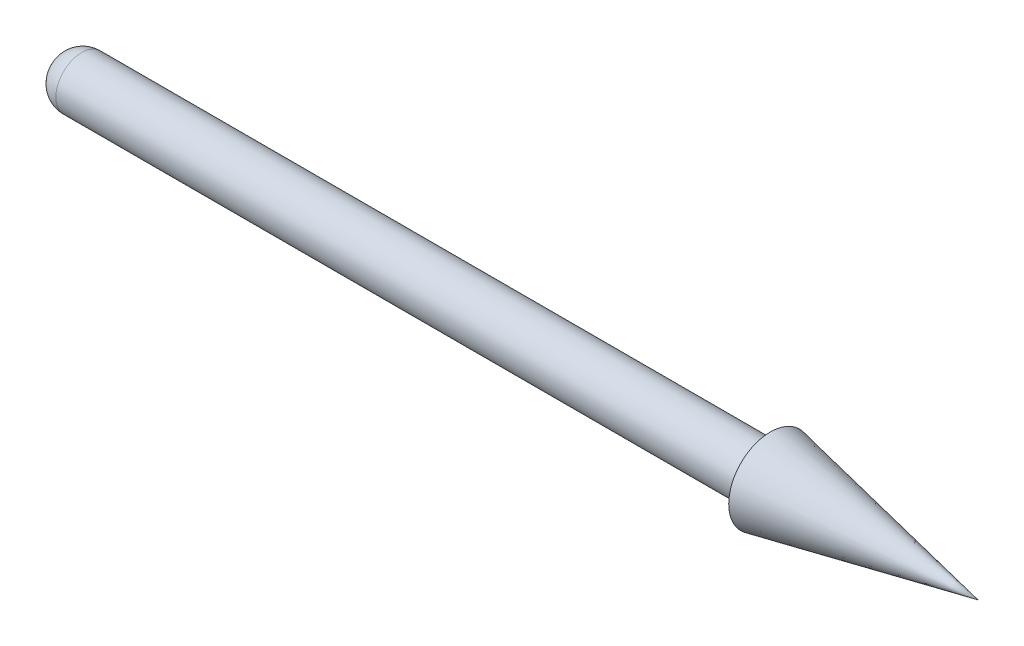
SolidWorks part; units mm, degrees
ref_plane "Plan de face" through (0, 0, 0) normal (0, 0, 1) x (1, 0, 0)
ref_plane "Plan de dessus" through (0, 0, 0) normal (0, 1, 0) x (1, 0, 0)
ref_plane "Plan de droite" through (0, 0, 0) normal (1, 0, 0) x (0, 0, -1)
sketch "Esquisse1" plane through (0, 0, 0) normal (0, 0, 1) x (1, 0, 0)
  line L0 (-1000, 0) -> (49000, 0) construction
  line L1 (0, -1000) -> (0, 49000) construction
  line L2 (-1, 0) -> (20, 0)
  line L3 (-0.2, 0.8742) -> (23, 0.8742)
  line L4 (-1, 0.0742) -> (-1, 0)
  line L5 (23, 0.8742) -> (23, 1.4)
  line L6 (23, 1.4) -> (30, 0)
  line L7 (30, 0) -> (20, 0)
  arc A0 (-0.2, 0.8742) -> (-1, 0.0742) centre (-0.2, 0.0742) ccw
  dimension "D1" = 0.8
revolve "Révolution1" add sketch "Esquisse1" angle 360 about L2
